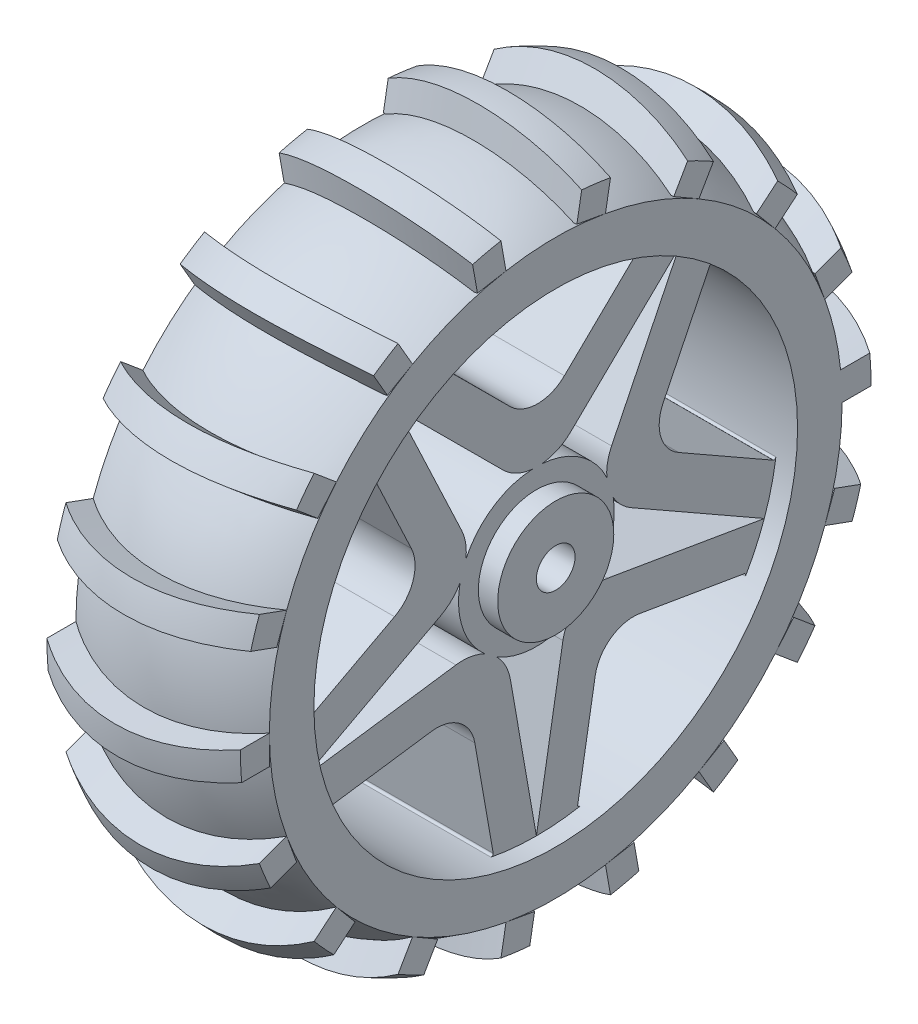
SolidWorks part; units mm, degrees
ref_plane "Front Plane" through (0, 0, 0) normal (0, 0, 1) x (1, 0, 0)
ref_plane "Top Plane" through (0, 0, 0) normal (0, 1, 0) x (1, 0, 0)
ref_plane "Right Plane" through (0, 0, 0) normal (1, 0, 0) x (0, 0, -1)
sketch "Sketch1" plane through (0, 0, 0) normal (1, 0, 0) x (0, 0, -1)
  circle A0 centre (0, 0) radius 35
  dimension "D1" = 70
extrude "Boss-Extrude1" add sketch "Sketch1" along normal blind 20
sketch "Sketch2" plane through (20, 0, 0) normal (1, 0, 0) x (0, 0, -1)
  circle A0 centre (0, 0) radius 2
  dimension "D1" = 4
extrude "Cut-Extrude1" cut sketch "Sketch2" against normal blind 20
sketch "Sketch3" plane through (0, 0, 0) normal (0, 0, 1) x (1, 0, 0)
  line L0 (20, 35) -> (0, 35) construction
  line L1 (-6.5877, 0) -> (24.1886, 0)
  line L2 (0, 35) -> (20, 35)
  arc A0 (0, 35) -> (20, 35) centre (10, 27.5) cw
  point P0 (10, 40)
  point P12 (10, 40)
  dimension "D1" = 5
revolve "Revolve1" add sketch "Sketch3" angle 360 about L1
sketch "Sketch10" plane through (0, 0, 0) normal (-1, 0, 0) x (0, 0, 1)
  circle A0 centre (0, 0) radius 25
  circle A1 centre (0, 0) radius 6
  dimension "D1" = 50
  dimension "D2" = 12
extrude "Cut-Extrude2" cut sketch "Sketch10" against normal blind 2
sketch "Sketch11" plane through (20, 0, 0) normal (1, 0, 0) x (0, 0, -1)
  circle A1 centre (0, 0) radius 6
  circle A2 centre (0, 0) radius 6
  circle A3 centre (0, 0) radius 25
  circle A4 centre (0, 0) radius 25
  dimension "D1" = 0
  dimension "D2" = 0
extrude "Cut-Extrude3" cut sketch "Sketch11" against normal blind 2
sketch "Sketch12" plane through (20, 0, 0) normal (1, 0, 0) x (0, 0, -1)
  circle A0 centre (0, 0) radius 32.6
  circle A2 centre (0, 0) radius 40
  point P4 (-32.6, 0)
  point P5 (-40, 0)
  dimension "D1" = 7.4
extrude "Cut-Extrude4" cut sketch "Sketch12" against normal blind 30
sketch "Sketch13" plane through (0, 0, 0) normal (0, 1, 0) x (1, 0, 0)
  line L0 (0, 32.6) -> (0, -32.6) construction
  line L1 (20, -32.6) -> (20, 32.6) construction
  line L2 (20, 32.6) -> (0, 32.6) construction
  line L3 (0, 29.6) -> (0, 39.0141)
  line L4 (0, 39.0141) -> (20, 39.0141)
  line L5 (20, 39.0141) -> (20, 29.6)
  line L6 (-7.8858, 0) -> (24.909, 0)
  arc A0 (0, 29.6) -> (20, 29.6) centre (10, 14.4333) cw
  point P0 (0, 29.6)
  point P1 (20, 29.6)
  point P4 (10, 32.6)
  dimension "D1" = 3
  dimension "D2" = 3
revolve "Cut-Revolve1" cut sketch "Sketch13" angle 360 about L6
ref_plane "Plane1" through (0, 0, -27) normal (0, 0, 1) x (1, 0, 0)
sketch "Sketch14" plane through (0, 0, -27) normal (0, 0, 1) x (1, 0, 0)
  line L0 (20, -29.6) -> (20, 29.6) construction
  line L1 (0, 29.6) -> (0, -29.6) construction
  line L2 (20, 0) -> (20, 3)
  line L3 (0, 0) -> (0, 3)
  arc A0 (0, 0) -> (20, 0) centre (10, -40.7922) cw
  arc A1 (0, 3) -> (20, 3) centre (10, -37.7922) cw
  point P0 (20, 0)
  point P1 (0, 0)
  point P4 (20, 3)
  point P6 (0, 3)
  dimension "D3" = 42
  dimension "D4" = 42
  dimension "D1" = 3
  dimension "D2" = 3
extrude "Boss-Extrude2" add sketch "Sketch14" against normal blind 10
sketch "Sketch15" plane through (0, 0, 0) normal (-1, 0, 0) x (0, 0, 1)
  line L0 (-37, 0) -> (-29.6, 0) construction
  line L1 (-37, 0) -> (-29.6, 0)
  line L2 (-37, 3) -> (-37, 0) construction
  line L3 (-37, 3) -> (-37, 0)
  line L4 (-37, 4.2078) -> (-37, 3) construction
  line L5 (-37, 4.2078) -> (-37, 3)
  line L6 (-32.3273, 4.2078) -> (-37, 4.2078) construction
  line L7 (-32.3273, 4.2078) -> (-37, 4.2078)
  line L8 (-29.6, 0) -> (-29.6, 4.2078)
  line L9 (-29.6, 4.2078) -> (-32.3273, 4.2078)
  line L10 (-26.3757, 14.0779) -> (-28.9385, 15.0107)
  line L11 (-33.7426, 15.4738) -> (-34.7686, 12.6547)
  line L12 (-28.9385, 15.0107) -> (-33.3295, 16.6088)
  line L13 (-33.3295, 16.6088) -> (-33.7426, 15.4738)
  line L14 (-34.7686, 12.6547) -> (-27.8149, 10.1238)
  line L15 (-27.8149, 10.1238) -> (-26.3757, 14.0779)
  line L16 (-19.9702, 22.2499) -> (-22.0594, 24.003)
  line L17 (-26.4153, 26.0813) -> (-28.3436, 23.7831)
  line L18 (-22.0594, 24.003) -> (-25.6389, 27.0065)
  line L19 (-25.6389, 27.0065) -> (-26.4153, 26.0813)
  line L20 (-28.3436, 23.7831) -> (-22.6749, 19.0265)
  line L21 (-22.6749, 19.0265) -> (-19.9702, 22.2499)
  line L22 (-11.1559, 27.7383) -> (-12.5195, 30.1002)
  line L23 (-15.9019, 33.5429) -> (-18.5, 32.0429)
  line L24 (-12.5195, 30.1002) -> (-14.8559, 34.1469)
  line L25 (-14.8559, 34.1469) -> (-15.9019, 33.5429)
  line L26 (-18.5, 32.0429) -> (-14.8, 25.6344)
  line L27 (-14.8, 25.6344) -> (-11.1559, 27.7383)
  line L28 (-0.9961, 29.881) -> (-1.4697, 32.5668)
  line L29 (-3.4706, 36.9588) -> (-6.425, 36.4379)
  line L30 (-1.4697, 32.5668) -> (-2.2811, 37.1686)
  line L31 (-2.2811, 37.1686) -> (-3.4706, 36.9588)
  line L32 (-6.425, 36.4379) -> (-5.14, 29.1503)
  line L33 (-5.14, 29.1503) -> (-0.9961, 29.881)
  line L34 (9.2839, 28.4196) -> (9.7575, 31.1055)
  line L35 (9.3794, 35.9169) -> (6.425, 36.4379)
  line L36 (9.7575, 31.1055) -> (10.5689, 35.7072)
  line L37 (10.5689, 35.7072) -> (9.3794, 35.9169)
  line L38 (6.425, 36.4379) -> (5.14, 29.1503)
  line L39 (5.14, 29.1503) -> (9.2839, 28.4196)
  line L40 (18.4441, 23.5304) -> (19.8077, 25.8923)
  line L41 (21.0981, 30.5429) -> (18.5, 32.0429)
  line L42 (19.8077, 25.8923) -> (22.1441, 29.939)
  line L43 (22.1441, 29.939) -> (21.0981, 30.5429)
  line L44 (18.5, 32.0429) -> (14.8, 25.6344)
  line L45 (14.8, 25.6344) -> (18.4441, 23.5304)
  line L46 (25.3797, 15.8031) -> (27.4689, 17.5562)
  line L47 (30.272, 21.485) -> (28.3436, 23.7831)
  line L48 (27.4689, 17.5562) -> (31.0484, 20.5597)
  line L49 (31.0484, 20.5597) -> (30.272, 21.485)
  line L50 (28.3436, 23.7831) -> (22.6749, 19.0265)
  line L51 (22.6749, 19.0265) -> (25.3797, 15.8031)
  line L52 (29.2541, 6.1697) -> (31.8169, 7.1025)
  line L53 (35.7947, 9.8357) -> (34.7686, 12.6547)
  line L54 (31.8169, 7.1025) -> (36.2078, 8.7007)
  line L55 (36.2078, 8.7007) -> (35.7947, 9.8357)
  line L56 (34.7686, 12.6547) -> (27.8149, 10.1238)
  line L57 (27.8149, 10.1238) -> (29.2541, 6.1697)
  line L58 (29.6, -4.2078) -> (32.3273, -4.2078)
  line L59 (37, -3) -> (37, 0)
  line L60 (32.3273, -4.2078) -> (37, -4.2078)
  line L61 (37, -4.2078) -> (37, -3)
  line L62 (37, 0) -> (29.6, 0)
  line L63 (29.6, 0) -> (29.6, -4.2078)
  line L64 (26.3757, -14.0779) -> (28.9385, -15.0107)
  line L65 (33.7426, -15.4738) -> (34.7686, -12.6547)
  line L66 (28.9385, -15.0107) -> (33.3295, -16.6088)
  line L67 (33.3295, -16.6088) -> (33.7426, -15.4738)
  line L68 (34.7686, -12.6547) -> (27.8149, -10.1238)
  line L69 (27.8149, -10.1238) -> (26.3757, -14.0779)
  line L70 (19.9702, -22.2499) -> (22.0594, -24.003)
  line L71 (26.4153, -26.0813) -> (28.3436, -23.7831)
  line L72 (22.0594, -24.003) -> (25.6389, -27.0065)
  line L73 (25.6389, -27.0065) -> (26.4153, -26.0813)
  line L74 (28.3436, -23.7831) -> (22.6749, -19.0265)
  line L75 (22.6749, -19.0265) -> (19.9702, -22.2499)
  line L76 (11.1559, -27.7383) -> (12.5195, -30.1002)
  line L77 (15.9019, -33.5429) -> (18.5, -32.0429)
  line L78 (12.5195, -30.1002) -> (14.8559, -34.1469)
  line L79 (14.8559, -34.1469) -> (15.9019, -33.5429)
  line L80 (18.5, -32.0429) -> (14.8, -25.6344)
  line L81 (14.8, -25.6344) -> (11.1559, -27.7383)
  line L82 (0.9961, -29.881) -> (1.4697, -32.5668)
  line L83 (3.4706, -36.9588) -> (6.425, -36.4379)
  line L84 (1.4697, -32.5668) -> (2.2811, -37.1686)
  line L85 (2.2811, -37.1686) -> (3.4706, -36.9588)
  line L86 (6.425, -36.4379) -> (5.14, -29.1503)
  line L87 (5.14, -29.1503) -> (0.9961, -29.881)
  line L88 (-9.2839, -28.4196) -> (-9.7575, -31.1055)
  line L89 (-9.3794, -35.9169) -> (-6.425, -36.4379)
  line L90 (-9.7575, -31.1055) -> (-10.5689, -35.7072)
  line L91 (-10.5689, -35.7072) -> (-9.3794, -35.9169)
  line L92 (-6.425, -36.4379) -> (-5.14, -29.1503)
  line L93 (-5.14, -29.1503) -> (-9.2839, -28.4196)
  line L94 (-18.4441, -23.5304) -> (-19.8077, -25.8923)
  line L95 (-21.0981, -30.5429) -> (-18.5, -32.0429)
  line L96 (-19.8077, -25.8923) -> (-22.1441, -29.939)
  line L97 (-22.1441, -29.939) -> (-21.0981, -30.5429)
  line L98 (-18.5, -32.0429) -> (-14.8, -25.6344)
  line L99 (-14.8, -25.6344) -> (-18.4441, -23.5304)
  line L100 (-25.3797, -15.8031) -> (-27.4689, -17.5562)
  line L101 (-30.272, -21.485) -> (-28.3436, -23.7831)
  line L102 (-27.4689, -17.5562) -> (-31.0484, -20.5597)
  line L103 (-31.0484, -20.5597) -> (-30.272, -21.485)
  line L104 (-28.3436, -23.7831) -> (-22.6749, -19.0265)
  line L105 (-22.6749, -19.0265) -> (-25.3797, -15.8031)
  line L106 (-29.2541, -6.1697) -> (-31.8169, -7.1025)
  line L107 (-35.7947, -9.8357) -> (-34.7686, -12.6547)
  line L108 (-31.8169, -7.1025) -> (-36.2078, -8.7007)
  line L109 (-36.2078, -8.7007) -> (-35.7947, -9.8357)
  line L110 (-34.7686, -12.6547) -> (-27.8149, -10.1238)
  line L111 (-27.8149, -10.1238) -> (-29.2541, -6.1697)
  point P110 (0, 0)
  dimension "D1" = 18
extrude "Boss-Extrude4" add sketch "Sketch15" against normal blind 20 contours L104 L105 L100 L102 L103 L101 | L20 L21 L16 L18 L19 L17 | L26 L27 L22 L24 L25 L23 | L32 L33 L28 L30 L31 L29 | L38 L39 L34 L36 L37 L35 | L44 L45 L40 L42 L43 L41 | L50 L51 L46 L48 L49 L47 | L62 L63 L58 L60 L61 L59 | L68 L69 L64 L66 L67 L65 | L74 L75 L70 L72 L73 L71 | L86 L87 L82 L84 L85 L83 | L92 L93 L88 L90 L91 L89 | L98 L99 L94 L96 L97 L95 | L108 L109 L107 L110 L111 L106 | L14 L15 L10 L12 L13 L11 | L53 L56 L57 L52 L54 L55 | L77 L80 L81 L76 L78 L79
sketch "Sketch17" plane through (0, 12.6547, -34.7686) normal (0, 0.342, -0.9397) x (-1, 0, 0)
  line L0 (-20, 4.2078) -> (-20, 0) construction
  line L1 (0, 4.2078) -> (0, 0) construction
  line L2 (-20, 3) -> (-20, 6.8749)
  line L3 (-20, 10.1238) -> (-20, 0) construction
  line L4 (-20, 6.8749) -> (0, 6.8749)
  line L5 (0, 0) -> (0, 10.1238) construction
  line L6 (0, 6.8749) -> (0, 3)
  line L7 (0, 0) -> (0, -3.0573)
  line L8 (0, -7.2526) -> (0, 0) construction
  line L9 (0, -3.0573) -> (-20, -3.0573)
  line L10 (-20, 0) -> (-20, -7.2526) construction
  line L11 (-20, -3.0573) -> (-20, 0)
  arc A0 (-20, 0) -> (0, 0) centre (-10, -40.7922) cw
  arc A1 (-20, 3) -> (0, 3) centre (-10, -37.7922) cw
  point P0 (-20, 0)
  point P1 (-20, 3)
  point P3 (0, 3)
  point P6 (0, 0)
  dimension "D3" = 42
  dimension "D4" = 42
  dimension "D1" = 3
  dimension "D2" = 3
extrude "Cut-Extrude5" cut sketch "Sketch17" against normal up to surface (7.4 mm away)
sketch "Sketch18" plane through (0, 23.7831, -28.3436) normal (0, 0.6428, -0.766) x (-1, 0, 0)
  line L0 (-20, 4.2078) -> (-20, 0) construction
  line L1 (0, 4.2078) -> (0, 0) construction
  line L2 (0, 3) -> (0, 6.4455)
  line L3 (0, 0) -> (0, 10.1238) construction
  line L4 (0, 6.4455) -> (-20, 6.4455)
  line L5 (-20, 10.1238) -> (-20, 0) construction
  line L6 (-20, 6.4455) -> (-20, 3)
  line L7 (0, 0) -> (0, -4.2078)
  line L8 (0, -4.2078) -> (-20, -4.2078)
  line L9 (-20, -4.2078) -> (-20, 0)
  arc A0 (-20, 0) -> (0, 0) centre (-10, -40.7922) cw
  arc A1 (-20, 3) -> (0, 3) centre (-10, -37.7922) cw
  point P0 (-20, 0)
  point P1 (-20, 3)
  point P3 (0, 3)
  point P6 (0, 0)
  dimension "D3" = 42
  dimension "D4" = 42
  dimension "D1" = 3
  dimension "D2" = 3
extrude "Cut-Extrude6" cut sketch "Sketch18" against normal up to surface (7.4 mm away)
sketch "Sketch19" plane through (0, 32.0429, -18.5) normal (0, 0.866, -0.5) x (1, 0, 0)
  line L0 (20, -4.2078) -> (20, 0) construction
  line L1 (0, -4.2078) -> (0, 0) construction
  line L2 (20, 0) -> (20, 2.3738)
  line L3 (20, 0) -> (20, 10.1238) construction
  line L4 (20, 2.3738) -> (0, 2.3738)
  line L5 (0, 10.1238) -> (0, 0) construction
  line L6 (0, 2.3738) -> (0, 0)
  line L7 (20, -3) -> (20, -6.7583)
  line L8 (20, -10.1238) -> (20, 0) construction
  line L9 (20, -6.7583) -> (0, -6.7583)
  line L10 (0, 0) -> (0, -10.1238) construction
  line L11 (0, -6.7583) -> (0, -3)
  arc A0 (20, 0) -> (0, 0) centre (10, 40.7922) cw
  arc A1 (20, -3) -> (0, -3) centre (10, 37.7922) cw
  point P0 (20, 0)
  point P1 (20, -3)
  point P3 (0, -3)
  point P6 (0, 0)
  point P9 (20, 0)
  point P11 (20, -3)
  dimension "D3" = 42
  dimension "D1" = 3
  dimension "D2" = 3
extrude "Cut-Extrude7" cut sketch "Sketch19" against normal up to surface (7.4 mm away)
sketch "Sketch20" plane through (0, 36.4379, -6.425) normal (0, 0.9848, -0.1736) x (1, 0, 0)
  line L0 (20, -4.2078) -> (20, 0) construction
  line L1 (0, -4.2078) -> (0, 0) construction
  line L2 (20, 0) -> (20, 2.6448)
  line L3 (20, 0) -> (20, 10.1238) construction
  line L4 (20, 2.6448) -> (0, 2.6448)
  line L5 (0, 10.1238) -> (0, 0) construction
  line L6 (0, 2.6448) -> (0, 0)
  line L7 (20, -3) -> (20, -6.4621)
  line L8 (20, -10.1238) -> (20, 0) construction
  line L9 (20, -6.4621) -> (0, -6.4621)
  line L10 (0, 0) -> (0, -10.1238) construction
  line L11 (0, -6.4621) -> (0, -3)
  arc A0 (20, 0) -> (0, 0) centre (10, 40.7922) cw
  arc A1 (20, -3) -> (0, -3) centre (10, 37.7922) cw
  point P0 (20, 0)
  point P1 (20, -3)
  point P3 (0, -3)
  point P6 (0, 0)
  dimension "D3" = 42
  dimension "D1" = 3
  dimension "D2" = 3
extrude "Cut-Extrude8" cut sketch "Sketch20" against normal up to surface (7.4 mm away)
sketch "Sketch21" plane through (0, 36.4379, 6.425) normal (0, 0.9848, 0.1736) x (1, 0, 0)
  line L0 (20, -4.2078) -> (20, 0) construction
  line L1 (0, -4.2078) -> (0, 0) construction
  line L2 (0, 0) -> (0, 3.4595)
  line L3 (0, 10.1238) -> (0, 0) construction
  line L4 (0, 3.4595) -> (20, 3.4595)
  line L5 (20, 0) -> (20, 10.1238) construction
  line L6 (20, 3.4595) -> (20, 0)
  line L7 (20, -3) -> (20, -6.9355)
  line L8 (20, -10.1238) -> (20, 0) construction
  line L9 (20, -6.9355) -> (0, -6.9355)
  line L10 (0, 0) -> (0, -10.1238) construction
  line L11 (0, -6.9355) -> (0, -3)
  arc A0 (20, 0) -> (0, 0) centre (10, 40.7922) cw
  arc A1 (20, -3) -> (0, -3) centre (10, 37.7922) cw
  point P0 (20, 0)
  point P1 (20, -3)
  point P3 (0, 0)
  point P6 (0, -3)
  dimension "D3" = 42
  dimension "D1" = 3
  dimension "D2" = 3
extrude "Cut-Extrude9" cut sketch "Sketch21" against normal up to surface (7.4 mm away)
sketch "Sketch22" plane through (0, 32.0429, 18.5) normal (0, 0.866, 0.5) x (1, 0, 0)
  line L0 (20, -4.2078) -> (20, 0) construction
  line L1 (0, -4.2078) -> (0, 0) construction
  line L2 (0, 0) -> (0, 3.4697)
  line L3 (0, 10.1238) -> (0, 0) construction
  line L4 (0, 3.4697) -> (20, 3.4697)
  line L5 (20, 0) -> (20, 10.1238) construction
  line L6 (20, 3.4697) -> (20, 0)
  line L7 (20, -3) -> (20, -7.5879)
  line L8 (20, -10.1238) -> (20, 0) construction
  line L9 (20, -7.5879) -> (0, -7.5879)
  line L10 (0, 0) -> (0, -10.1238) construction
  line L11 (0, -7.5879) -> (0, -3)
  arc A0 (20, 0) -> (0, 0) centre (10, 40.7922) cw
  arc A1 (20, -3) -> (0, -3) centre (10, 37.7922) cw
  point P0 (20, 0)
  point P1 (20, -3)
  point P3 (0, -3)
  point P6 (0, 0)
  dimension "D3" = 42
  dimension "D1" = 3
  dimension "D2" = 3
extrude "Cut-Extrude10" cut sketch "Sketch22" against normal up to surface (7.4 mm away)
sketch "Sketch23" plane through (0, 23.7831, 28.3436) normal (0, 0.6428, 0.766) x (1, 0, 0)
  line L0 (20, -4.2078) -> (20, 0) construction
  line L1 (0, -4.2078) -> (0, 0) construction
  line L2 (20, 0) -> (20, 2.5294)
  line L3 (20, 0) -> (20, 10.1238) construction
  line L4 (20, 2.5294) -> (0, 2.5294)
  line L5 (0, 10.1238) -> (0, 0) construction
  line L6 (0, 2.5294) -> (0, 0)
  line L7 (20, -3) -> (20, -5.9017)
  line L8 (20, -10.1238) -> (20, 0) construction
  line L9 (20, -5.9017) -> (0, -5.9017)
  line L10 (0, 0) -> (0, -10.1238) construction
  line L11 (0, -5.9017) -> (0, -3)
  arc A0 (20, 0) -> (0, 0) centre (10, 40.7922) cw
  arc A1 (20, -3) -> (0, -3) centre (10, 37.7922) cw
  point P0 (20, 0)
  point P1 (20, -3)
  point P3 (0, -3)
  point P6 (0, 0)
  dimension "D3" = 42
  dimension "D1" = 3
  dimension "D2" = 3
extrude "Cut-Extrude11" cut sketch "Sketch23" against normal up to surface (7.4 mm away)
sketch "Sketch24" plane through (0, 12.6547, 34.7686) normal (0, 0.342, 0.9397) x (1, 0, 0)
  line L0 (20, -4.2078) -> (20, 0) construction
  line L1 (0, -4.2078) -> (0, 0) construction
  line L2 (20, 0) -> (20, 4.2078)
  line L3 (20, 4.2078) -> (0, 4.2078)
  line L4 (0, 10.1238) -> (0, 0) construction
  line L5 (0, 4.2078) -> (0, 0)
  line L6 (20, -3) -> (20, -7.2272)
  line L7 (20, -10.1238) -> (20, 0) construction
  line L8 (20, -7.2272) -> (0, -7.2272)
  line L9 (0, 0) -> (0, -10.1238) construction
  line L10 (0, -7.2272) -> (0, -3)
  arc A0 (20, 0) -> (0, 0) centre (10, 40.7922) cw
  arc A1 (20, -3) -> (0, -3) centre (10, 37.7922) cw
  point P0 (20, 0)
  point P1 (20, -3)
  point P3 (0, -3)
  point P6 (0, 0)
  dimension "D3" = 42
  dimension "D1" = 3
  dimension "D2" = 3
extrude "Cut-Extrude12" cut sketch "Sketch24" against normal up to surface (7.4 mm away)
sketch "Sketch25" plane through (0, 0, 37) normal (0, 0, 1) x (1, 0, 0)
  line L0 (20, -4.2078) -> (20, 0) construction
  line L1 (0, -4.2078) -> (0, 0) construction
  line L2 (0, 0) -> (0, 5.0619)
  line L3 (0, 10.1238) -> (0, 0) construction
  line L4 (0, 5.0619) -> (20, 5.0619)
  line L5 (20, 0) -> (20, 10.1238) construction
  line L6 (20, 5.0619) -> (20, 0)
  line L7 (20, -3) -> (20, -6.8479)
  line L8 (20, -10.1238) -> (20, 0) construction
  line L9 (20, -6.8479) -> (0, -6.8479)
  line L10 (0, 0) -> (0, -10.1238) construction
  line L11 (0, -6.8479) -> (0, -3)
  arc A0 (20, 0) -> (0, 0) centre (10, 40.7922) cw
  arc A1 (20, -3) -> (0, -3) centre (10, 37.7922) cw
  point P0 (20, 0)
  point P1 (20, -3)
  point P3 (0, 0)
  point P6 (0, -3)
  dimension "D3" = 42
  dimension "D1" = 3
  dimension "D2" = 3
extrude "Cut-Extrude13" cut sketch "Sketch25" against normal up to surface (7.4 mm away)
sketch "Sketch26" plane through (0, -12.6547, 34.7686) normal (0, -0.342, 0.9397) x (1, 0, 0)
  line L0 (20, -4.2078) -> (20, 0) construction
  line L1 (0, -4.2078) -> (0, 0) construction
  line L2 (20, 0) -> (20, 3.5074)
  line L3 (20, 0) -> (20, 10.1238) construction
  line L4 (20, 3.5074) -> (0, 3.5074)
  line L5 (0, 10.1238) -> (0, 0) construction
  line L6 (0, 3.5074) -> (0, 0)
  line L7 (20, -3) -> (20, -5.7086)
  line L8 (20, -10.1238) -> (20, 0) construction
  line L9 (20, -5.7086) -> (0, -5.7086)
  line L10 (0, 0) -> (0, -10.1238) construction
  line L11 (0, -5.7086) -> (0, -3)
  arc A0 (20, 0) -> (0, 0) centre (10, 40.7922) cw
  arc A1 (20, -3) -> (0, -3) centre (10, 37.7922) cw
  point P0 (20, 0)
  point P1 (20, -3)
  point P3 (0, -3)
  point P6 (0, 0)
  dimension "D3" = 42
  dimension "D1" = 3
  dimension "D2" = 3
extrude "Cut-Extrude14" cut sketch "Sketch26" against normal up to surface (7.4 mm away)
sketch "Sketch27" plane through (0, -23.7831, 28.3436) normal (0, -0.6428, 0.766) x (1, 0, 0)
  line L0 (20, -4.2078) -> (20, 0) construction
  line L1 (0, -4.2078) -> (0, 0) construction
  line L2 (20, 0) -> (20, 3)
  line L3 (20, 3) -> (0, 3)
  line L4 (0, 3) -> (0, 0)
  line L5 (20, -3) -> (20, -7.0101)
  line L6 (20, -10.1238) -> (20, 0) construction
  line L7 (20, -7.0101) -> (0, -7.0101)
  line L8 (0, 0) -> (0, -10.1238) construction
  line L9 (0, -7.0101) -> (0, -3)
  arc A0 (20, 0) -> (0, 0) centre (10, 40.7922) cw
  arc A1 (20, -3) -> (0, -3) centre (10, 37.7922) cw
  point P0 (20, 0)
  point P1 (20, -3)
  point P3 (0, -3)
  point P6 (0, 0)
  dimension "D3" = 42
  dimension "D1" = 3
  dimension "D2" = 3
extrude "Cut-Extrude15" cut sketch "Sketch27" against normal up to surface (7.4 mm away)
sketch "Sketch28" plane through (0, -32.0429, 18.5) normal (0, -0.866, 0.5) x (1, 0, 0)
  line L0 (20, -4.2078) -> (20, 0) construction
  line L1 (0, -4.2078) -> (0, 0) construction
  line L2 (20, 0) -> (20, 3)
  line L3 (20, 3) -> (0, 3)
  line L4 (0, 3) -> (0, 0)
  line L5 (20, -3) -> (20, -7.1096)
  line L6 (20, -10.1238) -> (20, 0) construction
  line L7 (20, -7.1096) -> (0, -7.1096)
  line L8 (0, 0) -> (0, -10.1238) construction
  line L9 (0, -7.1096) -> (0, -3)
  arc A0 (20, 0) -> (0, 0) centre (10, 40.7922) cw
  arc A1 (20, -3) -> (0, -3) centre (10, 37.7922) cw
  point P0 (20, 0)
  point P1 (20, -3)
  point P3 (0, -3)
  point P6 (0, 0)
  dimension "D3" = 42
  dimension "D1" = 3
  dimension "D2" = 3
extrude "Cut-Extrude16" cut sketch "Sketch28" against normal up to surface (7.4 mm away)
sketch "Sketch29" plane through (0, -36.4379, 6.425) normal (0, -0.9848, 0.1736) x (1, 0, 0)
  line L0 (20, -4.2078) -> (20, 0) construction
  line L1 (0, -4.2078) -> (0, 0) construction
  line L2 (0, 0) -> (0, 2.7282)
  line L3 (0, 10.1238) -> (0, 0) construction
  line L4 (0, 2.7282) -> (20, 2.7282)
  line L5 (20, 0) -> (20, 10.1238) construction
  line L6 (20, 2.7282) -> (20, 0)
  line L7 (20, -3) -> (20, -6.4018)
  line L8 (20, -10.1238) -> (20, 0) construction
  line L9 (20, -6.4018) -> (0, -6.4018)
  line L10 (0, 0) -> (0, -10.1238) construction
  line L11 (0, -6.4018) -> (0, -3)
  arc A0 (20, 0) -> (0, 0) centre (10, 44.7555) cw
  arc A1 (20, -3) -> (0, -3) centre (10, 37.7922) cw
  point P0 (20, 0)
  point P1 (20, -3)
  point P3 (0, 0)
  point P6 (0, -3)
  dimension "D1" = 3
  dimension "D2" = 3
extrude "Cut-Extrude17" cut sketch "Sketch29" against normal up to surface (7.4 mm away)
sketch "Sketch30" plane through (0, -36.4379, -6.425) normal (0, -0.9848, -0.1736) x (1, 0, 0)
  line L0 (20, -4.2078) -> (20, 0) construction
  line L1 (0, -4.2078) -> (0, 0) construction
  line L2 (20, 0) -> (20, 3.8245)
  line L3 (20, 0) -> (20, 10.1238) construction
  line L4 (20, 3.8245) -> (0, 3.8245)
  line L5 (0, 10.1238) -> (0, 0) construction
  line L6 (0, 3.8245) -> (0, 0)
  line L7 (20, -3) -> (20, -6.3756)
  line L8 (20, -10.1238) -> (20, 0) construction
  line L9 (20, -6.3756) -> (0, -6.3756)
  line L10 (0, 0) -> (0, -10.1238) construction
  line L11 (0, -6.3756) -> (0, -3)
  arc A0 (20, 0) -> (0, 0) centre (10, 40.7922) cw
  arc A1 (20, -3) -> (0, -3) centre (10, 37.7922) cw
  point P0 (20, 0)
  point P1 (20, -3)
  point P3 (0, -3)
  point P6 (0, 0)
  dimension "D3" = 42
  dimension "D1" = 3
  dimension "D2" = 3
extrude "Cut-Extrude18" cut sketch "Sketch30" against normal up to surface (7.4 mm away)
sketch "Sketch31" plane through (0, -32.0429, -18.5) normal (0, -0.866, -0.5) x (1, 0, 0)
  line L0 (20, -4.2078) -> (20, 0) construction
  line L1 (0, -4.2078) -> (0, 0) construction
  line L2 (0, 0) -> (0, 3.8817)
  line L3 (0, 10.1238) -> (0, 0) construction
  line L4 (0, 3.8817) -> (20, 3.8817)
  line L5 (20, 0) -> (20, 10.1238) construction
  line L6 (20, 3.8817) -> (20, 0)
  line L7 (20, -3) -> (20, -6.5708)
  line L8 (20, -10.1238) -> (20, 0) construction
  line L9 (20, -6.5708) -> (0, -6.5708)
  line L10 (0, 0) -> (0, -10.1238) construction
  line L11 (0, -6.5708) -> (0, -3)
  arc A0 (20, 0) -> (0, 0) centre (10, 40.7922) cw
  arc A1 (20, -3) -> (0, -3) centre (10, 37.7922) cw
  point P0 (20, 0)
  point P1 (20, -3)
  point P3 (0, 0)
  point P6 (0, -3)
  dimension "D3" = 42
  dimension "D1" = 3
  dimension "D2" = 3
extrude "Cut-Extrude19" cut sketch "Sketch31" against normal up to surface (7.4 mm away)
sketch "Sketch32" plane through (0, -23.7831, -28.3436) normal (0, -0.6428, -0.766) x (-1, 0, 0)
  line L0 (0, 4.2078) -> (0, 0) construction
  line L1 (-20, 4.2078) -> (-20, 0) construction
  line L2 (-20, 3) -> (-20, 6.6294)
  line L3 (-20, 10.1238) -> (-20, 0) construction
  line L4 (-20, 6.6294) -> (0, 6.6294)
  line L5 (0, 0) -> (0, 10.1238) construction
  line L6 (0, 6.6294) -> (0, 3)
  line L7 (0, 0) -> (0, -2.9911)
  line L8 (0, -10.1238) -> (0, 0) construction
  line L9 (0, -2.9911) -> (-20, -2.9911)
  line L10 (-20, 0) -> (-20, -10.1238) construction
  line L11 (-20, -2.9911) -> (-20, 0)
  arc A0 (-20, 0) -> (0, 0) centre (-10, -40.7922) cw
  arc A1 (-20, 3) -> (0, 3) centre (-10, -37.7922) cw
  point P0 (-20, 0)
  point P1 (0, 0)
  point P3 (0, 3)
  point P5 (-20, 3)
  dimension "D3" = 42
  dimension "D1" = 3
  dimension "D2" = 3
extrude "Cut-Extrude20" cut sketch "Sketch32" against normal up to surface (7.4 mm away)
sketch "Sketch33" plane through (0, -12.6547, -34.7686) normal (0, -0.342, -0.9397) x (-1, 0, 0)
  line L0 (0, 4.2078) -> (0, 0) construction
  line L1 (-20, 4.2078) -> (-20, 0) construction
  line L2 (-20, 3) -> (-20, 7.3047)
  line L3 (-20, 7.3047) -> (0, 7.3047)
  line L4 (0, 0) -> (0, 10.1238) construction
  line L5 (0, 7.3047) -> (0, 3)
  line L6 (0, 0) -> (0, -2.9632)
  line L7 (0, -10.1238) -> (0, 0) construction
  line L8 (0, -2.9632) -> (-20, -2.9632)
  line L9 (-20, 0) -> (-20, -10.1238) construction
  line L10 (-20, -2.9632) -> (-20, 0)
  arc A0 (-20, 0) -> (0, 0) centre (-10, -40.7922) cw
  arc A1 (-20, 3) -> (0, 3) centre (-10, -37.7922) cw
  point P0 (0, 0)
  point P1 (0, 3)
  point P3 (-20, 3)
  point P6 (-20, 0)
  dimension "D3" = 42
  dimension "D1" = 3
  dimension "D2" = 3
extrude "Cut-Extrude21" cut sketch "Sketch33" against normal up to surface (7.4 mm away)
sketch "Sketch34" plane through (0, 0, 0) normal (0, 1, 0) x (1, 0, 0)
  line L0 (20, 37) -> (20, 29.6) construction
  line L1 (0, 37) -> (0, 29.6) construction
  line L2 (20, 32.6) -> (20, 40.0185)
  line L3 (20, 40.0185) -> (0, 40.0185)
  line L4 (0, 29.6) -> (0, 27.8149)
  line L5 (20, 27.8149) -> (20, 29.6)
  line L8 (0, 40.0185) -> (0, 32.6)
  line L9 (-7.3871, 0) -> (38.3068, 0)
  arc A0 (0, 32.6) -> (20, 32.6) centre (10, 17.2739) cw
  arc A1 (0, 29.6) -> (20, 29.6) centre (10, 14.2739) cw
  spline S0 degree 3 poles (-586.4561, -2907.7772) (-67.0639, -481.3011) (88.0206, -1.8942) (16.9241, 31.2451) (16.1052, 31.5571) (14.8319, 31.9377) (14.3989, 32.05) (13.5328, 32.2413) (13.0978, 32.3208) (11.7874, 32.5121) (10.9063, 32.5768) (9.5734, 32.578) (9.1258, 32.5623) (8.2332, 32.4983) (7.791, 32.4502) (6.4767, 32.2594) (5.6165, 32.0702) (3.9279, 31.5685) (3.0943, 31.253) (-85.1493, -9.8064) (218.0642, -721.363) (99.8984, -2965.0051) knots -10.99393 -10.99393 -10.99393 -10.99393 0.125 0.125 0.25 0.25 0.3125 0.3125 0.375 0.375 0.5 0.5 0.5625 0.5625 0.625 0.625 0.75 0.75 0.875 0.875 14.575953 14.575953 14.575953 14.575953 only from (20, 29.6) to (0, 29.6) construction
  spline S1 degree 3 poles (20, 29.6) (19.2668, 30.0834) (18.5049, 30.5083) (16.9241, 31.2451) (16.1052, 31.5571) (14.8319, 31.9377) (14.3989, 32.05) (13.5328, 32.2413) (13.0978, 32.3208) (11.7874, 32.5121) (10.9063, 32.5768) (9.5734, 32.578) (9.1258, 32.5623) (8.2332, 32.4983) (7.791, 32.4502) (6.4767, 32.2594) (5.6165, 32.0702) (3.9279, 31.5685) (3.0943, 31.253) (1.4987, 30.5106) (0.7334, 30.0836) (0, 29.6) knots 0 0 0 0 0.125 0.125 0.25 0.25 0.3125 0.3125 0.375 0.375 0.5 0.5 0.5625 0.5625 0.625 0.625 0.75 0.75 0.875 0.875 1 1 1 1
  spline S6 degree 3 poles (-996.8451, -51.5547) (1895.9558, -104.3467) (-1526.5223, 82.4076) (1000.1012, 43.5052) knots -111.02768 -111.02768 -111.02768 -111.02768 50.809377 50.809377 50.809377 50.809377 only from (0, 27.8149) to (0.2433, 28.8611)
  spline S7 degree 3 poles (-793.2044, -3886.1622) (-108.2854, -605.0008) (96.603, -5.8946) (16.9241, 31.2451) (16.1052, 31.5571) (14.8319, 31.9377) (14.3989, 32.05) (13.5328, 32.2413) (13.0978, 32.3208) (11.7874, 32.5121) (10.9063, 32.5768) (9.5734, 32.578) (9.1258, 32.5623) (8.2332, 32.4983) (7.791, 32.4502) (6.4767, 32.2594) (5.6165, 32.0702) (3.9279, 31.5685) (3.0943, 31.253) (-96.9837, -15.3128) (307.2894, -926.2456) (26.7571, -3962.2435) knots -12.351238 -12.351238 -12.351238 -12.351238 0.125 0.125 0.25 0.25 0.3125 0.3125 0.375 0.375 0.5 0.5 0.5625 0.5625 0.625 0.625 0.75 0.75 0.875 0.875 16.430155 16.430155 16.430155 16.430155 only from (20, 29.6) to (0, 29.6)
  spline S8 degree 3 poles (-980.1352, 43.5047) (1546.549, 82.4092) (-1875.9579, -104.3463) (1016.8313, -51.555) knots -49.810103 -49.810103 -49.810103 -49.810103 112.027424 112.027424 112.027424 112.027424 only from (19.7567, 28.8611) to (20, 27.8149)
  spline S9 degree 3 poles (0.2433, 28.8611) (1.6903, 29.8161) (3.2395, 30.5492) (5.3085, 31.1802) (5.7298, 31.2919) (6.5723, 31.4822) (6.995, 31.5614) (8.2677, 31.7517) (9.1221, 31.816) (10.8428, 31.8177) (11.7153, 31.7536) (13.4195, 31.5) (14.256, 31.3115) (15.4879, 30.938) (15.8947, 30.7984) (16.7007, 30.4884) (17.101, 30.3175) (18.278, 29.7634) (19.0323, 29.3392) (19.7567, 28.8611) knots 0 0 0 0 0.25 0.25 0.3125 0.3125 0.375 0.375 0.5 0.5 0.625 0.625 0.75 0.75 0.8125 0.8125 0.875 0.875 1 1 1 1
  spline S11 degree 3 poles (20, 29.6) (19.2668, 30.0834) (18.5049, 30.5083) (16.9241, 31.2451) (16.1052, 31.5571) (14.8319, 31.9377) (14.3989, 32.05) (13.5328, 32.2413) (13.0978, 32.3208) (11.7874, 32.5121) (10.9063, 32.5768) (9.5734, 32.578) (9.1258, 32.5623) (8.2332, 32.4983) (7.791, 32.4502) (6.4767, 32.2594) (5.6165, 32.0702) (3.9279, 31.5685) (3.0943, 31.253) (1.4987, 30.5106) (0.7334, 30.0836) (0, 29.6) knots 0 0 0 0 0.125 0.125 0.25 0.25 0.3125 0.3125 0.375 0.375 0.5 0.5 0.5625 0.5625 0.625 0.625 0.75 0.75 0.875 0.875 1 1 1 1
  point P2 (20, 32.6)
  point P3 (0, 32.6)
  point P11 (20, 29.6)
  point P12 (0, 29.6)
  point P14 (10, 34.8858)
  dimension "D3" = 0
  dimension "D4" = 18.3
  dimension "D5" = 18.3
  dimension "D1" = 3
  dimension "D2" = 3
revolve "Cut-Revolve2" cut sketch "Sketch34" angle 360 about L9
sketch "Sketch35" plane through (2, 0, 0) normal (-1, 0, 0) x (0, 0, 1)
  line L12 (0, -25) -> (-2.7416, -8.8786)
  line L13 (-23.5602, -8.3616) -> (-7.3556, -5.6058)
  line L14 (-4.268, -24.3612) -> (-6.0799, -13.7068)
  line L15 (-10.6939, -10.4341) -> (-21.4736, -12.2673)
  line L19 (-3.5715, 9.4264) -> (-14.6959, 20.2245)
  line L20 (3.4419, 9.4738) -> (14.4199, 20.4222)
  line L21 (-13.0958, 7.1995) -> (-17.9035, 17.0592)
  line L22 (7.7226, 6.202) -> (14.4199, 20.4222)
  line L23 (9.8981, -0.3429) -> (23.7767, -7.7247)
  line L24 (-14.7093, 1.9719) -> (-24.4642, -3.5921)
  line L25 (2.7126, 14.7933) -> (10.3843, 22.4442)
  line L26 (-2.898, 14.7553) -> (-10.6772, 22.3063)
  line L27 (12.923, 7.1952) -> (17.6784, 17.2923)
  line L28 (23.7767, -7.7247) -> (8.3191, -5.5334)
  line L29 (2.6921, -9.6218) -> (0, -25)
  line L30 (14.6634, 1.9593) -> (24.5113, -3.2786)
  line L31 (10.8633, -10.2184) -> (21.7535, -11.7622)
  line L34 (6.3618, -13.489) -> (4.4651, -24.3234)
  line L35 (-7.7732, 6.0272) -> (-14.6959, 20.2245)
  line L36 (-9.7902, -0.5075) -> (-23.5602, -8.3616)
  arc A0 (-18.2291, 17.1085) -> (-24.7614, -3.4459) centre (0, 0) ccw
  arc A1 (-18.0298, 17.3183) -> (-24.7191, -3.7375) centre (0, 0) ccw
  circle A2 centre (0, 0) radius 25 construction
  circle A3 centre (0, 0) radius 6 construction
  circle A4 centre (0, 0) radius 25 construction
  circle A5 centre (0, 0) radius 6 construction
  arc A7 (-9.7902, -0.5075) -> (-7.7732, 6.0272) centre (-12.2674, 3.8357) ccw
  arc A9 (2.6921, -9.6218) -> (8.3191, -5.5334) centre (7.6173, -10.484) cw
  arc A10 (9.8981, -0.3429) -> (7.7226, 6.202) centre (12.2461, 4.0716) cw
  arc A11 (-3.5715, 9.4264) -> (3.4419, 9.4738) centre (-0.0889, 13.0142) ccw
  arc A12 (12.923, 7.1952) -> (14.6634, 1.9593) centre (16.5417, 5.4908) ccw
  arc A13 (-13.0958, 7.1995) -> (-14.7093, 1.9719) centre (-16.6911, 5.4464) cw
  arc A14 (-2.7416, -8.8786) -> (-7.3556, -5.6058) centre (-6.685, -9.5492) ccw
  arc A15 (10.8633, -10.2184) -> (6.3618, -13.489) centre (10.3019, -14.1788) ccw
  arc A16 (2.7126, 14.7933) -> (-2.898, 14.7553) centre (-0.112, 17.6255) cw
  arc A18 (-21.613, -12.565) -> (-4.5012, -24.5914) centre (0, 0) ccw
  arc A19 (10.3257, 22.768) -> (-10.6229, 22.6308) centre (0, 0) ccw
  arc A20 (10.5879, 22.6472) -> (-10.8836, 22.5066) centre (0, 0) ccw
  arc A21 (24.8037, -3.1271) -> (18.0034, 17.3458) centre (0, 0) ccw
  arc A22 (24.7658, -3.414) -> (17.8013, 17.5532) centre (0, 0) ccw
  arc A23 (4.6997, -24.5543) -> (21.9006, -12.0567) centre (0, 0) ccw
  arc A24 (4.4155, -24.607) -> (22.0386, -11.8026) centre (0, 0) ccw
  arc A25 (-6.0799, -13.7068) -> (-10.6939, -10.4341) centre (-10.0233, -14.3774) ccw
  arc A26 (-24.4642, -3.5921) -> (-24.7614, -3.4459) centre (-24.5633, -3.4184) cw
  arc A27 (-17.9035, 17.0592) -> (-18.2291, 17.1085) centre (-18.0833, 16.9716) ccw
  arc A28 (-10.6772, 22.3063) -> (-10.6229, 22.6308) centre (-10.5379, 22.4498) cw
  arc A29 (10.3843, 22.4442) -> (10.3257, 22.768) centre (10.2431, 22.5858) ccw
  arc A30 (17.6784, 17.2923) -> (18.0034, 17.3458) centre (17.8594, 17.207) cw
  arc A31 (24.5113, -3.2786) -> (24.8037, -3.1271) centre (24.6052, -3.1021) ccw
  arc A32 (21.7535, -11.7622) -> (21.9006, -12.0567) centre (21.7254, -11.9602) cw
  arc A33 (4.4651, -24.3234) -> (4.6997, -24.5543) centre (4.6621, -24.3578) ccw
  arc A34 (-21.613, -12.565) -> (-21.4736, -12.2673) centre (-21.4401, -12.4644) cw
  arc A35 (-4.5012, -24.5914) -> (-4.268, -24.3612) centre (-4.4652, -24.3947) ccw
  point P40 (-5.719, 1.8145)
  point P43 (0, -6)
  point P46 (3.5268, -4.854)
  point P49 (5.6934, 1.8935)
  point P52 (-0.0415, 5.9999)
  point P60 (-11.4525, 3.8295)
  point P61 (-0.0551, 8.0142)
  point P62 (7.5013, 2.4944)
  point P63 (4.6783, -6.4389)
  point P65 (-7.4898, 2.3611)
  point P83 (-11.4525, 3.8295)
  point P93 (-21.7562, -12.3153)
  point P96 (-4.2204, -24.6412)
  dimension "D1" = 4
  dimension "D2" = 4
  dimension "D3" = 4
  dimension "D4" = 0.2
  dimension "D5" = 0.2
extrude "Cut-Extrude22" cut sketch "Sketch35" against normal blind 20 contours L14 A25 L15 A34 A18 A35 | L30 A31 A21 A30 L27 A12 | L31 A32 A23 A33 L34 A15 | L25 A29 A19 A28 L26 A16 | L21 A27 A0 A26 L24 A13
sketch "Sketch36" plane through (0, 0, 0) normal (-1, 0, 0) x (0, 0, 1)
  line L2 (17.6784, 17.2923) -> (12.923, 7.1952)
  line L3 (14.6634, 1.9593) -> (24.5113, -3.2786)
  line L6 (21.7535, -11.7622) -> (10.8633, -10.2184)
  line L7 (6.3618, -13.489) -> (4.4651, -24.3234)
  line L10 (-3.5715, 9.4264) -> (-14.6959, 20.2245)
  line L11 (-14.6959, 20.2245) -> (-7.7732, 6.0272)
  line L12 (-9.7902, -0.5075) -> (-23.5602, -8.3616)
  line L13 (-23.5602, -8.3616) -> (-7.3556, -5.6058)
  line L14 (-2.7416, -8.8786) -> (0, -25)
  line L15 (0, -25) -> (2.6921, -9.6218)
  line L16 (8.3191, -5.5334) -> (23.7767, -7.7247)
  line L17 (23.7767, -7.7247) -> (9.8981, -0.3429)
  line L18 (7.7226, 6.202) -> (14.4199, 20.4222)
  line L19 (14.4199, 20.4222) -> (3.4419, 9.4738)
  line L20 (-3.5715, 9.4264) -> (-14.6959, 20.2245)
  line L21 (-14.6959, 20.2245) -> (-7.7732, 6.0272)
  line L22 (-9.7902, -0.5075) -> (-23.5602, -8.3616)
  line L23 (-23.5602, -8.3616) -> (-7.3556, -5.6058)
  line L24 (-2.7416, -8.8786) -> (0, -25)
  line L25 (0, -25) -> (2.6921, -9.6218)
  line L26 (8.3191, -5.5334) -> (23.7767, -7.7247)
  line L27 (23.7767, -7.7247) -> (9.8981, -0.3429)
  line L28 (7.7226, 6.202) -> (14.4199, 20.4222)
  line L29 (14.4199, 20.4222) -> (3.4419, 9.4738)
  line L30 (2.7126, 14.7933) -> (10.3843, 22.4442)
  line L31 (-10.6772, 22.3063) -> (-2.898, 14.7553)
  line L34 (-24.4642, -3.5921) -> (-14.7093, 1.9719)
  line L35 (-13.0958, 7.1995) -> (-17.9035, 17.0592)
  line L38 (-4.268, -24.3612) -> (-6.0799, -13.7068)
  line L39 (-10.6939, -10.4341) -> (-21.4736, -12.2673)
  arc A0 (-18.0298, 17.3183) -> (-24.7191, -3.7375) centre (0, 0) ccw construction
  arc A1 (4.4155, -24.607) -> (22.0386, -11.8026) centre (0, 0) ccw construction
  arc A2 (24.7658, -3.414) -> (17.8013, 17.5532) centre (0, 0) ccw construction
  arc A3 (10.5879, 22.6472) -> (-10.8836, 22.5066) centre (0, 0) ccw construction
  arc A4 (12.923, 7.1952) -> (14.6634, 1.9593) centre (16.5417, 5.4908) ccw
  arc A5 (-9.7902, -0.5075) -> (-7.7732, 6.0272) centre (-12.2674, 3.8357) ccw
  arc A6 (-2.7416, -8.8786) -> (-7.3556, -5.6058) centre (-6.685, -9.5492) ccw
  arc A7 (8.3191, -5.5334) -> (2.6921, -9.6218) centre (7.6173, -10.484) ccw
  arc A8 (7.7226, 6.202) -> (9.8981, -0.3429) centre (12.2461, 4.0716) ccw
  arc A9 (-3.5715, 9.4264) -> (3.4419, 9.4738) centre (-0.0889, 13.0142) ccw
  arc A10 (-9.7902, -0.5075) -> (-7.9389, 1.3328) centre (-12.2674, 3.8357) ccw
  arc A11 (-2.7416, -8.8786) -> (-3.3701, -7.3106) centre (-6.685, -9.5492) ccw
  arc A12 (8.3191, -5.5334) -> (5.3162, -6.0449) centre (7.6173, -10.484) ccw
  arc A13 (7.7226, 6.202) -> (7.2892, 3.4162) centre (12.2461, 4.0716) ccw
  arc A14 (-3.5715, 9.4264) -> (-0.5232, 8.033) centre (-0.0889, 13.0142) ccw
  arc A15 (18.0034, 17.3458) -> (17.6784, 17.2923) centre (17.8594, 17.207) ccw
  arc A16 (24.8037, -3.1271) -> (18.0034, 17.3458) centre (0, 0) ccw
  arc A17 (24.5113, -3.2786) -> (24.8037, -3.1271) centre (24.6052, -3.1021) ccw
  arc A19 (18.0034, 17.3458) -> (17.6784, 17.2923) centre (17.8594, 17.207) ccw
  arc A20 (24.8037, -3.1271) -> (18.0034, 17.3458) centre (0, 0) ccw
  arc A21 (24.5113, -3.2786) -> (24.8037, -3.1271) centre (24.6052, -3.1021) ccw
  arc A22 (21.9006, -12.0567) -> (21.7535, -11.7622) centre (21.7254, -11.9602) ccw
  arc A23 (4.6997, -24.5543) -> (21.9006, -12.0567) centre (0, 0) ccw
  arc A24 (4.4651, -24.3234) -> (4.6997, -24.5543) centre (4.6621, -24.3578) ccw
  arc A25 (10.8633, -10.2184) -> (6.3618, -13.489) centre (10.3019, -14.1788) ccw
  arc A26 (21.9006, -12.0567) -> (21.7535, -11.7622) centre (21.7254, -11.9602) ccw
  arc A27 (4.6997, -24.5543) -> (21.9006, -12.0567) centre (0, 0) ccw
  arc A28 (4.4651, -24.3234) -> (4.6997, -24.5543) centre (4.6621, -24.3578) ccw
  arc A30 (10.3843, 22.4442) -> (10.3257, 22.768) centre (10.2431, 22.5858) ccw
  arc A31 (10.3257, 22.768) -> (-10.6229, 22.6308) centre (0, 0) ccw
  arc A32 (-10.6229, 22.6308) -> (-10.6772, 22.3063) centre (-10.5379, 22.4498) ccw
  arc A33 (-2.898, 14.7553) -> (2.7126, 14.7933) centre (-0.112, 17.6255) ccw
  arc A34 (10.3843, 22.4442) -> (10.3257, 22.768) centre (10.2431, 22.5858) ccw
  arc A36 (-10.6229, 22.6308) -> (-10.6772, 22.3063) centre (-10.5379, 22.4498) ccw
  arc A38 (-24.7614, -3.4459) -> (-24.4642, -3.5921) centre (-24.5633, -3.4184) ccw
  arc A39 (-18.2291, 17.1085) -> (-24.7614, -3.4459) centre (0, 0) ccw
  arc A40 (-17.9035, 17.0592) -> (-18.2291, 17.1085) centre (-18.0833, 16.9716) ccw
  arc A41 (-14.7093, 1.9719) -> (-13.0958, 7.1995) centre (-16.6911, 5.4464) ccw
  arc A42 (-24.7614, -3.4459) -> (-24.4642, -3.5921) centre (-24.5633, -3.4184) ccw
  arc A44 (-17.9035, 17.0592) -> (-18.2291, 17.1085) centre (-18.0833, 16.9716) ccw
  arc A46 (-6.0799, -13.7068) -> (-10.6939, -10.4341) centre (-10.0233, -14.3774) ccw
  arc A47 (-21.4736, -12.2673) -> (-21.613, -12.565) centre (-21.4401, -12.4644) ccw
  arc A48 (-21.613, -12.565) -> (-4.5012, -24.5914) centre (0, 0) ccw
  arc A49 (-4.5012, -24.5914) -> (-4.268, -24.3612) centre (-4.4652, -24.3947) ccw
  arc A51 (-21.4736, -12.2673) -> (-21.613, -12.565) centre (-21.4401, -12.4644) ccw
  arc A52 (-21.613, -12.565) -> (-4.5012, -24.5914) centre (0, 0) ccw
  arc A53 (-4.5012, -24.5914) -> (-4.268, -24.3612) centre (-4.4652, -24.3947) ccw
  arc A54 (-18.0298, 17.3183) -> (-18.2291, 17.1085) centre (0, 0) ccw
  arc A55 (4.4155, -24.607) -> (22.0386, -11.8026) centre (0, 0) ccw
  arc A56 (24.7658, -3.414) -> (17.8013, 17.5532) centre (0, 0) ccw
  arc A57 (10.5879, 22.6472) -> (10.3257, 22.768) centre (0, 0) ccw
  arc A59 (-24.7614, -3.4459) -> (-24.7191, -3.7375) centre (0, 0) ccw
  arc A60 (-10.6229, 22.6308) -> (-10.8836, 22.5066) centre (0, 0) ccw
  arc A61 (-3.3701, -7.3106) -> (4.1065, -6.9238) centre (0, 0) ccw
  arc A62 (-5.7159, -5.6684) -> (-7.3556, -5.6058) centre (-6.685, -9.5492) ccw
  arc A63 (-7.2841, 3.427) -> (-7.7732, 6.0272) centre (-12.2674, 3.8357) ccw
  arc A64 (-7.9389, 1.3328) -> (-5.7159, -5.6684) centre (0, 0) ccw
  arc A65 (0.4134, 8.0394) -> (3.4419, 9.4738) centre (-0.0889, 13.0142) ccw
  arc A66 (-0.5232, 8.033) -> (-7.2841, 3.427) centre (0, 0) ccw
  arc A67 (7.2892, 3.4162) -> (0.4134, 8.0394) centre (0, 0) ccw
  arc A68 (7.8836, 1.6284) -> (9.8981, -0.3429) centre (12.2461, 4.0716) ccw
  arc A69 (5.3162, -6.0449) -> (7.8836, 1.6284) centre (0, 0) ccw
  arc A70 (4.1065, -6.9238) -> (2.6921, -9.6218) centre (7.6173, -10.484) ccw
  dimension "D7" = 16.1
  dimension "D1" = 0
  dimension "D2" = 0
  dimension "D3" = 0
  dimension "D4" = 0
  dimension "D5" = 0
  dimension "D6" = 0
extrude "Cut-Extrude23" cut sketch "Sketch36" against normal blind 20 contours L27 A68 A69 A12 L26 | L28 L29 A65 A67 A13 | L20 L21 A63 A66 A14 | L22 L23 A62 A64 A10 | L24 L25 A70 A61 A11
